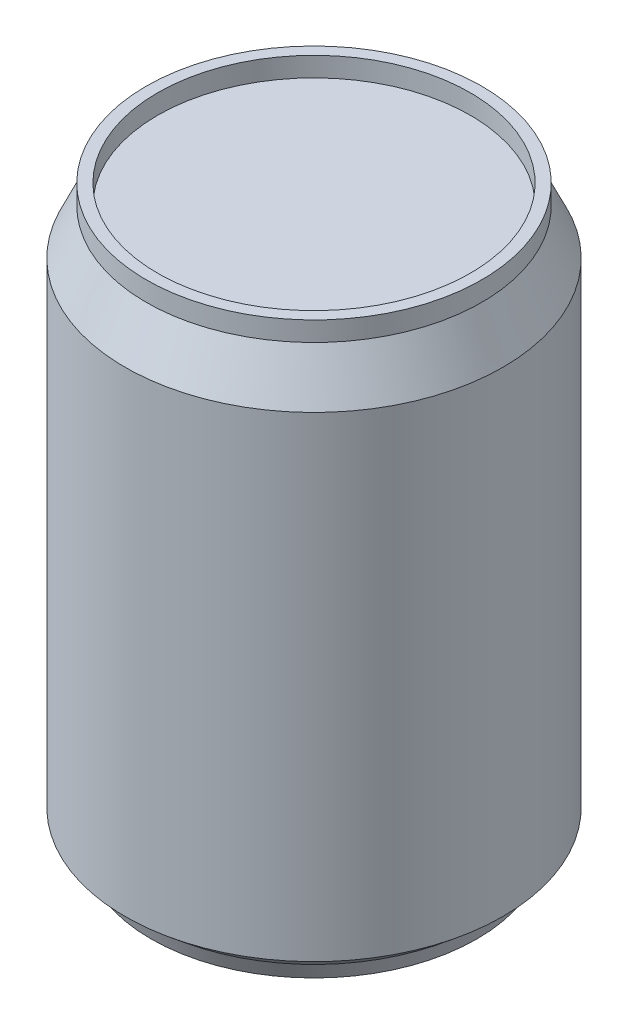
SolidWorks part; units mm, degrees
ref_plane "Plan de face" through (0, 0, 0) normal (0, 0, 1) x (1, 0, 0)
ref_plane "Plan de dessus" through (0, 0, 0) normal (0, 1, 0) x (1, 0, 0)
ref_plane "Plan de droite" through (0, 0, 0) normal (1, 0, 0) x (0, 0, -1)
sketch "Esquisse1" plane through (0, 0, 0) normal (0, 0, 1) x (1, 0, 0)
  line L0 (0, 0) -> (0, 88) construction
  line L1 (0, 85) -> (-24, 85)
  line L2 (-24, 85) -> (-24, 88)
  line L3 (-24, 88) -> (-25.75, 88)
  line L4 (-25.75, 88) -> (-25.75, 85)
  line L5 (-25.75, 85) -> (-29, 78)
  line L6 (-29, 78) -> (-29, 5)
  line L7 (-29, 5) -> (-26, 2.5)
  line L8 (-26, 2.5) -> (-25, 0)
  line L9 (-25, 0) -> (-22, 0)
  line L10 (-22, 0) -> (-22, 2.5)
  line L11 (0, 0) -> (0, -26.0167) construction
  line L12 (-26, 2.5) -> (-22, 2.5) construction
  line L13 (0, 85) -> (0, 10)
  arc A0 (0, 10) -> (-22, 2.5) centre (0, -26.0167) ccw
  dimension "D1" = 88
  dimension "D2" = 24
  dimension "D3" = 25.75
  dimension "D4" = 29
  dimension "D5" = 3
  dimension "D6" = 3
  dimension "D7" = 10
  dimension "D8" = 26
  dimension "D9" = 5
  dimension "D10" = 2.5
  dimension "D11" = 25
  dimension "D12" = 22
  dimension "D13" = 10
revolve "Révolution1" add sketch "Esquisse1" angle 360 about L13
